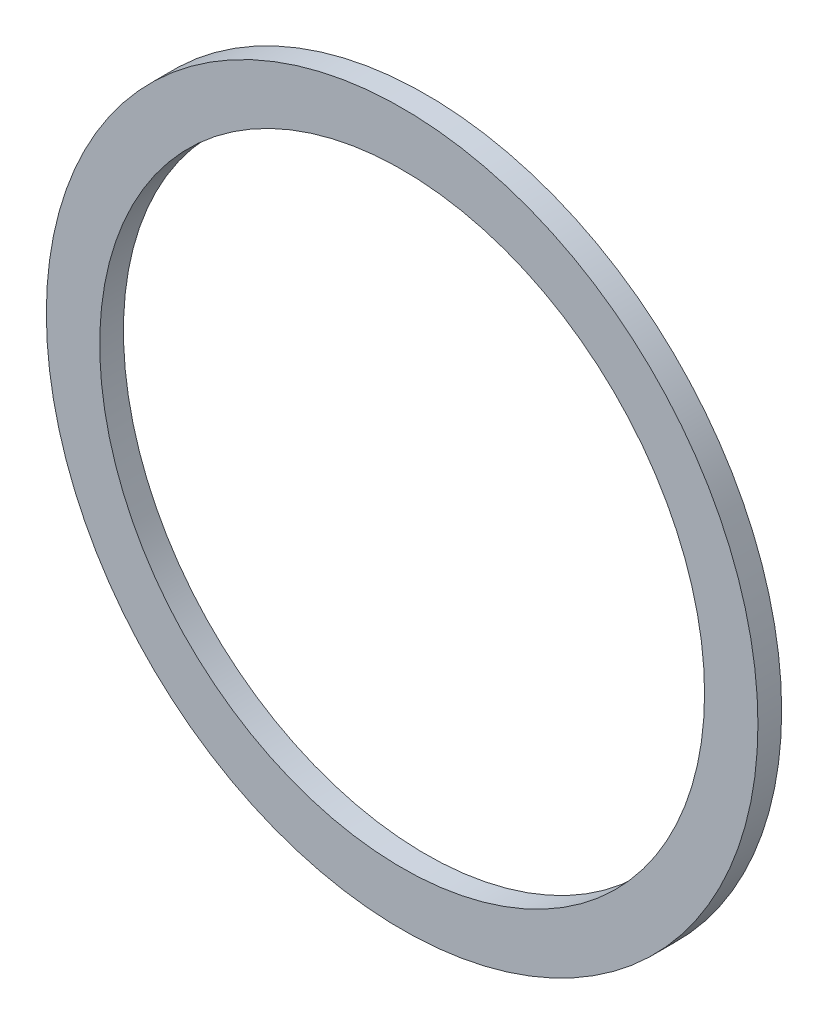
SolidWorks part; units mm, degrees
ref_plane "Ebene vorne" through (0, 0, 0) normal (0, 0, 1) x (1, 0, 0)
ref_plane "Ebene oben" through (0, 0, 0) normal (0, 1, 0) x (1, 0, 0)
ref_plane "Ebene rechts" through (0, 0, 0) normal (1, 0, 0) x (0, 0, -1)
sketch "Skizze1" plane through (0, 0, 0) normal (0, 0, 1) x (1, 0, 0)
  circle A0 centre (0, 0) radius 25.5
  circle A1 centre (0, 0) radius 30
  dimension "D1" = 60
  dimension "D2" = 4.5
extrude "Aufsatz-Linear austragen1" add sketch "Skizze1" along normal blind 2
